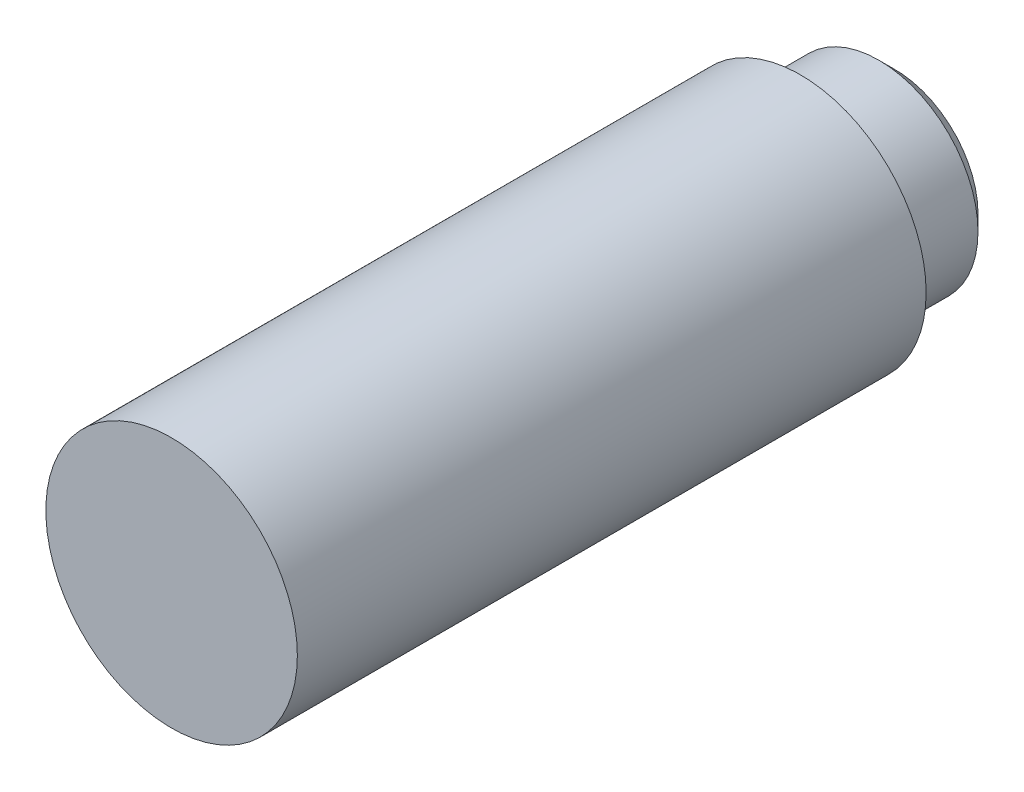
SolidWorks part; units mm, degrees
ref_plane "Plan de face" through (0, 0, 0) normal (0, 0, 1) x (1, 0, 0)
ref_plane "Plan de dessus" through (0, 0, 0) normal (0, 1, 0) x (1, 0, 0)
ref_plane "Plan de droite" through (0, 0, 0) normal (1, 0, 0) x (0, 0, -1)
sketch "Esquisse1" plane through (0, 0, 0) normal (0, 0, 1) x (1, 0, 0)
  circle A0 centre (0, 0) radius 3.15
  dimension "D1" = 6.3
extrude "Boss.-Extru.1" add sketch "Esquisse1" along normal blind 3
sketch "Esquisse2" plane through (0, 0, 3) normal (0, 0, 1) x (1, 0, 0)
  circle A0 centre (0, 0) radius 4
  dimension "D1" = 8
extrude "Boss.-Extru.2" add sketch "Esquisse2" along normal blind 20
chamfer "Chanfrein1" distance 0.5 angle 45 1 edges at (3.15, 0, 0)
